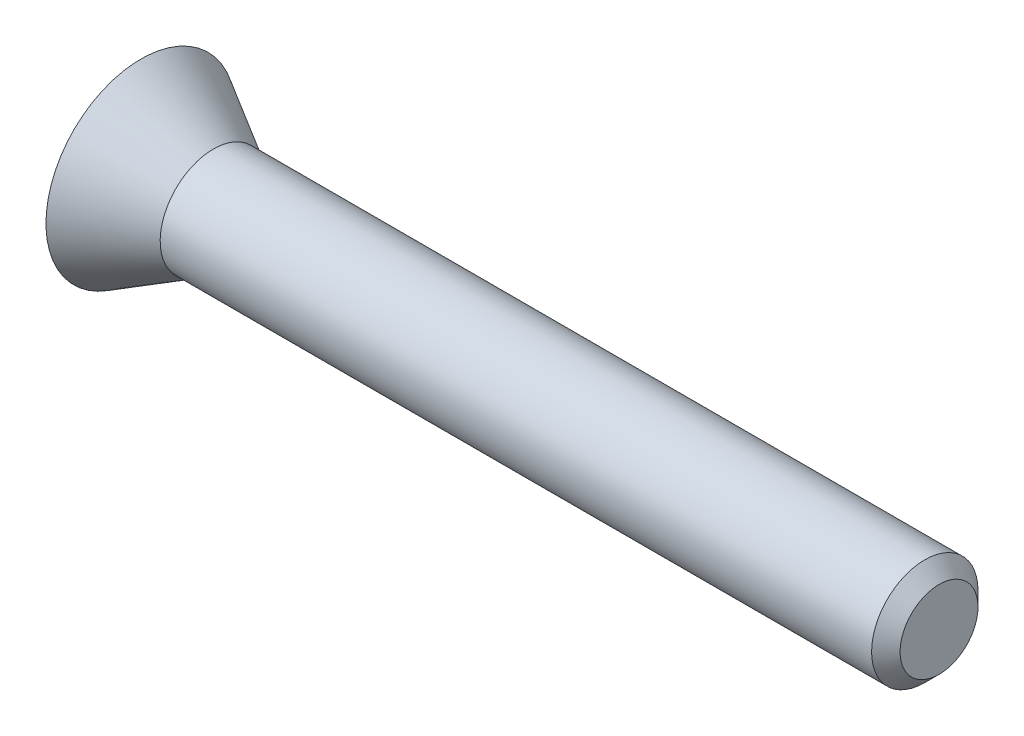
SolidWorks part; units mm, degrees
ref_plane "Front Plane" through (0, 0, 0) normal (0, 0, 1) x (1, 0, 0)
ref_plane "Top Plane" through (0, 0, 0) normal (0, 1, 0) x (1, 0, 0)
ref_plane "Right Plane" through (0, 0, 0) normal (1, 0, 0) x (0, 0, -1)
sketch "Sketch1" plane through (0, 0, 0) normal (1, 0, 0) x (0, 0, -1)
  circle A0 centre (0, 0) radius 1.25
  dimension "D1" = 2.5
extrude "Boss-Extrude1" add sketch "Sketch1" along normal mid plane 10.5 contours A0
sketch "Sketch2" plane through (0, 0, 0) normal (0, 0, 1) x (1, 0, 0)
  line L0 (-4.2974, 0.7) -> (5.25, 0.7)
  line L1 (5.25, -1.25) -> (5.25, 1.25) construction
  line L2 (5.25, 0.7) -> (5.25, 1.25)
  line L3 (-4.2974, 0.7) -> (-5.25, 1.25)
  line L4 (-5.25, 1.25) -> (5.25, 1.25)
  line L5 (-5.25, 1.25) -> (-5.25, -1.25) construction
  line L6 (-5.25, 0) -> (5.25, 0) construction
  dimension "D1" = 30
  dimension "D2" = 1.4
revolve "Cut-Revolve1" cut sketch "Sketch2" angle 360 about L6
sketch "Sketch3" plane through (-5.25, 0, 0) normal (-1, 0, 0) x (0, 0, 1)
  line L1 (0.125, 0.55) -> (0.125, -0.825)
  line L2 (0.3, 0.55) -> (0.125, 0.55)
  line L3 (0, 1.05) -> (0.3, 0.55)
  line L4 (0, 1.05) -> (-0.3, 0.55)
  line L5 (-0.3, 0.55) -> (-0.125, 0.55)
  line L6 (-0.125, 0.55) -> (-0.125, -0.825)
  line L7 (0, 1.25) -> (0, -1.25) construction
  arc A0 (-0.125, -0.825) -> (0.125, -0.825) centre (0, -0.825) ccw
  circle A1 centre (0, 0) radius 1.25 construction
  dimension "D6" = 0.25
  dimension "D2" = 0.3
  dimension "D3" = 0.6
  dimension "D1" = 0.2
  dimension "D5" = 0.5
extrude "Cut-Extrude1" cut sketch "Sketch3" against normal blind 0.3
chamfer "Chamfer1" distance 0.1875 angle 45 1 edges at (5.25, -0.7, 0)
sketch "Sketch4" plane through (-5.25, 0, 0) normal (-1, 0, 0) x (0, 0, 1)
  text T0 "2  7" font "Bahnschrift" height 1
  dimension "D1" = 0.6
extrude "Cut-Extrude2" cut sketch "Sketch4" against normal blind 0.3
